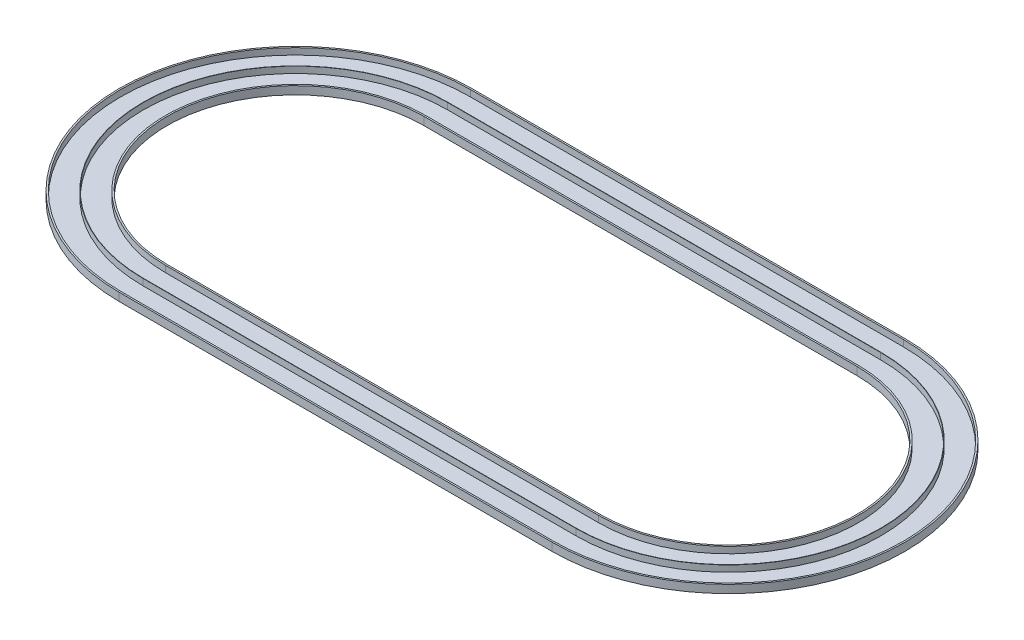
SolidWorks part; units mm, degrees
ref_plane "Front Plane" through (0, 0, 0) normal (0, 0, 1) x (1, 0, 0)
ref_plane "Top Plane" through (0, 0, 0) normal (0, 1, 0) x (1, 0, 0)
ref_plane "Right Plane" through (0, 0, 0) normal (1, 0, 0) x (0, 0, -1)
sketch "Sketch1" plane through (0, 0, 0) normal (0, 1, 0) x (1, 0, 0)
  line L0 (0, 0) -> (685.8, 0) construction
  line L1 (0, 279.4) -> (685.8, 279.4)
  line L2 (0, -279.4) -> (685.8, -279.4)
  line L3 (0, 0) -> (685.8, 0) construction
  line L4 (0, 203.2) -> (685.8, 203.2)
  line L5 (0, -203.2) -> (685.8, -203.2)
  arc A0 (0, 279.4) -> (0, -279.4) centre (0, 0) ccw
  arc A1 (685.8, -279.4) -> (685.8, 279.4) centre (685.8, 0) ccw
  arc A2 (0, 203.2) -> (0, -203.2) centre (0, 0) ccw
  arc A3 (685.8, -203.2) -> (685.8, 203.2) centre (685.8, 0) ccw
  point P3 (342.9, 0)
  point P10 (342.9, 0)
  dimension "D1" = 76.2
  dimension "D2" = 203.2
  dimension "D3" = 685.8
extrude "Boss-Extrude1" add sketch "Sketch1" along normal blind 12.7
shell "Shell1" thickness 2.54
sketch "Sketch2" plane through (0, 2.54, 0) normal (0, 1, 0) x (1, 0, 0)
  line L0 (0, 0) -> (685.8, 0) construction
  line L1 (0, 241.046) -> (685.8, 241.046)
  line L2 (0, -241.046) -> (685.8, -241.046)
  line L3 (685.8, 0) -> (0, 0) construction
  line L4 (685.8, -241.554) -> (0, -241.554)
  line L5 (685.8, 241.554) -> (0, 241.554)
  arc A0 (0, 241.046) -> (0, -241.046) centre (0, 0) ccw
  arc A1 (685.8, -241.046) -> (685.8, 241.046) centre (685.8, 0) ccw
  arc A2 (685.8, -241.554) -> (685.8, 241.554) centre (685.8, 0) ccw
  arc A3 (0, 241.554) -> (0, -241.554) centre (0, 0) ccw
  point P4 (342.9, 0)
  point P9 (342.9, 0)
  dimension "D1" = 37.846
  dimension "D2" = 37.846
extrude "Boss-Extrude2" add sketch "Sketch2" along normal blind 10.16
